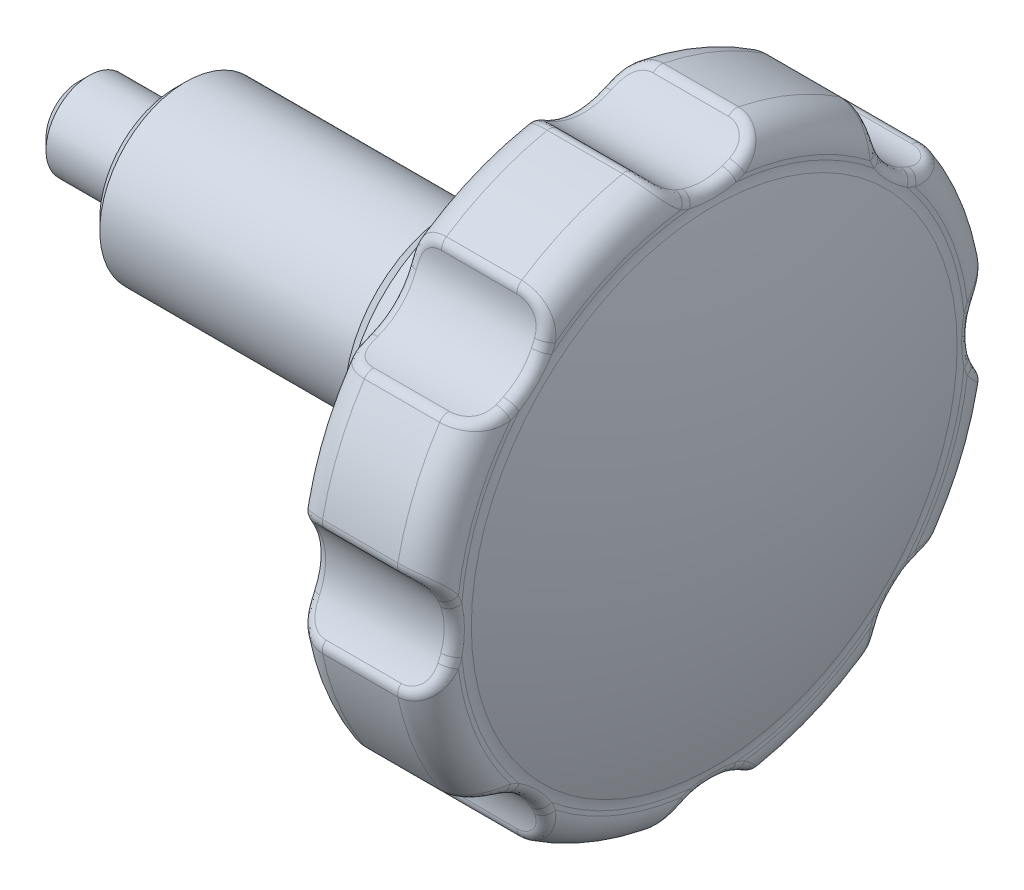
SolidWorks part; units mm, degrees
ref_plane "Plan de face" through (0, 0, 0) normal (0, 0, 1) x (1, 0, 0)
ref_plane "Plan de dessus" through (0, 0, 0) normal (0, 1, 0) x (1, 0, 0)
ref_plane "Plan de droite" through (0, 0, 0) normal (1, 0, 0) x (0, 0, -1)
sketch "Esquisse1" plane through (0, 0, 0) normal (0, 0, 1) x (1, 0, 0)
  line L0 (-62.5, 0) -> (-62.5, 3)
  line L1 (-62.5, 3) -> (-61.5, 4)
  line L2 (-61.5, 4) -> (-53.5, 4)
  line L3 (-53.5, 4) -> (-53.5, 7)
  line L4 (-53.5, 7) -> (-52.5, 8)
  line L5 (-52.5, 8) -> (-27.5, 8)
  line L6 (-27.5, 8) -> (-27.5, 10.25)
  line L7 (24.7588, 0) -> (-87.8314, 0) construction
  line L8 (-25.5, 12.25) -> (-16.5, 12.25)
  line L9 (-27.5, 10.25) -> (-25.5, 12.25)
  line L10 (-16.5, 12.25) -> (-16.5, 23.8375)
  line L12 (-13.5, 26.8375) -> (-6.5, 26.8375)
  line L14 (-3.5, 23.8375) -> (-3.5, 23.4418)
  line L16 (0, 0) -> (-62.5, 0)
  arc A0 (-3.3749, 22.5846) -> (0, 0) centre (-80.9981, -0.5595) cw
  arc A1 (-3.5, 23.8375) -> (-6.5, 26.8375) centre (-6.5, 23.8375) ccw
  arc A2 (-13.5, 26.8375) -> (-16.5, 23.8375) centre (-13.5, 23.8375) ccw
  arc A3 (-3.5, 23.4418) -> (-3.3749, 22.5846) centre (-0.5, 23.4418) ccw
  point P9 (-27.5, 12.25)
  point P14 (-3.5, 26.8375)
  point P22 (-16.5, 26.8375)
  point P25 (-3.5, 23)
  dimension "D8" = 81
  dimension "D15" = 3
  dimension "D1" = 62.5
  dimension "D2" = 3
  dimension "D3" = 4
  dimension "D4" = 8
  dimension "D5" = 13
  dimension "D6" = 12.25
  dimension "D7" = 26.8375
  dimension "D9" = 25
  dimension "D10" = 1
  dimension "D11" = 1
  dimension "D12" = 23
  dimension "D13" = 8
  dimension "D14" = 11
  dimension "D18" = 2
revolve "Révolution1" add sketch "Esquisse1" angle 360 about L7
sketch "Esquisse2" plane through (-16.5, 0, 0) normal (-1, 0, 0) x (0, 0, 1)
  circle A0 centre (30, 0) radius 6
  dimension "D2" = 12
  dimension "D1" = 30
extrude "Enlèv. mat.-Extru.1" cut sketch "Esquisse2" against normal through all
fillet "Congé1" radius 1 4 edges at (-10, 4.8031, 26.4042) (-10, -4.8031, 26.4042) (-16.4954, 0.1928, 24.0031) (-3.5046, -0.1928, 24.0031)
pattern_circular "Répétition circulaire1" count 8 every 45 about axis through (24.7588, 0, 0) along (1, 0, 0) of "Congé1", "Enlèv. mat.-Extru.1"
